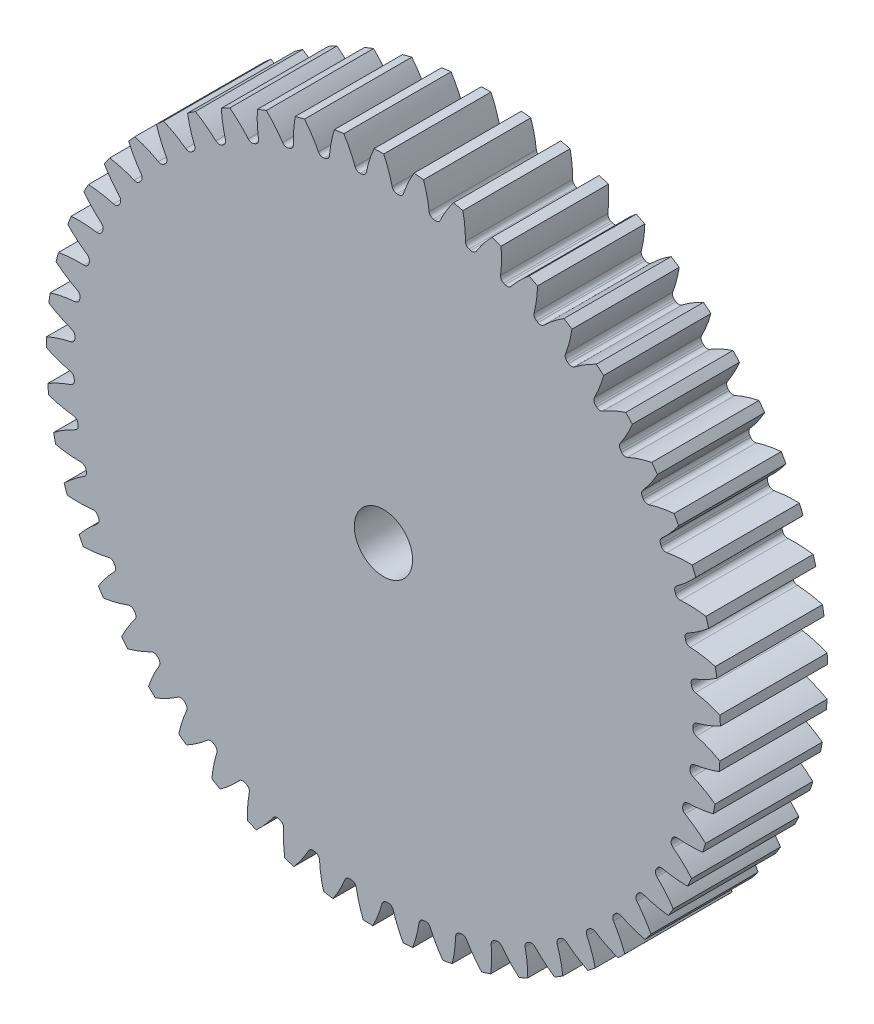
SolidWorks part; units mm, degrees
ref_plane "Front" through (0, 0, 0) normal (0, 0, 1) x (1, 0, 0)
ref_plane "Top" through (0, 0, 0) normal (0, 1, 0) x (1, 0, 0)
ref_plane "Right" through (0, 0, 0) normal (1, 0, 0) x (0, 0, -1)
sketch "Sketch3" plane through (0, 0, 0) normal (0, 0, 1) x (1, 0, 0)
  circle A0 centre (0, 0) radius 279.4
  dimension "od" = 558.8
extrude "gearBody" add sketch "Sketch3" along normal blind 88.9
sketch "Sketch2" plane through (0, 0, 0) normal (0, 0, 1) x (1, 0, 0)
  line L0 (0, 0) -> (233.7441, 96.82) construction
  line L1 (278.9907, -17.1686) -> (0, 0) construction
  line L2 (0, 0) -> (36.3143, 0) construction
  line L3 (269.216, 3.594) -> (268.9589, -12.2997) construction
  line L5 (269.0875, -4.3528) -> (0, 0) construction
  line L7 (0, 0) -> (253.0028, 0) construction
  arc A0 (253.0007, -1.0499) -> (252.9022, -7.1337) centre (0, 0) ccw construction
  arc A1 (279.2833, 8.0759) -> (278.8759, -17.1048) centre (0, 0) ccw construction
  arc A2 (269.216, 3.594) -> (268.9589, -12.2997) centre (0, 0) ccw construction
  arc A3 (256.4944, -4.8382) -> (256.5167, -3.4605) centre (0, 0) ccw
  arc A4 (278.9907, -17.1686) -> (259.4291, -8.8734) centre (230.4903, -104.3296) ccw
  arc A5 (278.9907, -17.1686) -> (279.4, 8.1359) centre (0, 0) ccw
  arc A6 (279.4, 8.1359) -> (259.5803, 0.4778) centre (233.7441, 96.82) cw
  arc A7 (256.5167, -3.4605) -> (259.5803, 0.4778) centre (260.6514, -3.5162) cw
  arc A8 (259.4291, -8.8734) -> (256.4944, -4.8382) centre (260.6288, -4.9162) cw
  point P6 (279.4, 8.1359)
  point P22 (278.9907, -17.1686)
  dimension "baseDia" = 506.0057
  dimension "od" = 558.8
  dimension "pd" = 538.48
  dimension "rd" = 513.08
  dimension "rFillet" = 4.1351
  dimension "pointX" = 279.4
  dimension "pointY" = 8.1359
  dimension "CTT" = 15.8937
  dimension "flankCenterAngle" = 22.5
extrude "toothCut" cut sketch "Sketch2" along normal through all
pattern_circular "CirPattern1" count 53 over 360 about axis through (0, 0, 0) along (0, 0, 1) of "toothCut"
sketch "hub1Dia" plane through (0, 0, 0) normal (0, 0, -1) x (-1, 0, 0)
  circle A0 centre (0, 0) radius 12.7
  dimension "hub1Dia" = 25.4
sketch "hub2Dia" plane through (0, 0, 88.9) normal (0, 0, 1) x (1, 0, 0)
  circle A0 centre (0, 0) radius 12.7
  dimension "hub2dia" = 25.4
sketch "boreDia" plane through (0, 0, 0) normal (0, 0, 1) x (1, 0, 0)
  circle A0 centre (0, 0) radius 24.13
  dimension "boreDia" = 48.26
extrude "bore" cut sketch "boreDia" against normal mid plane 25400
